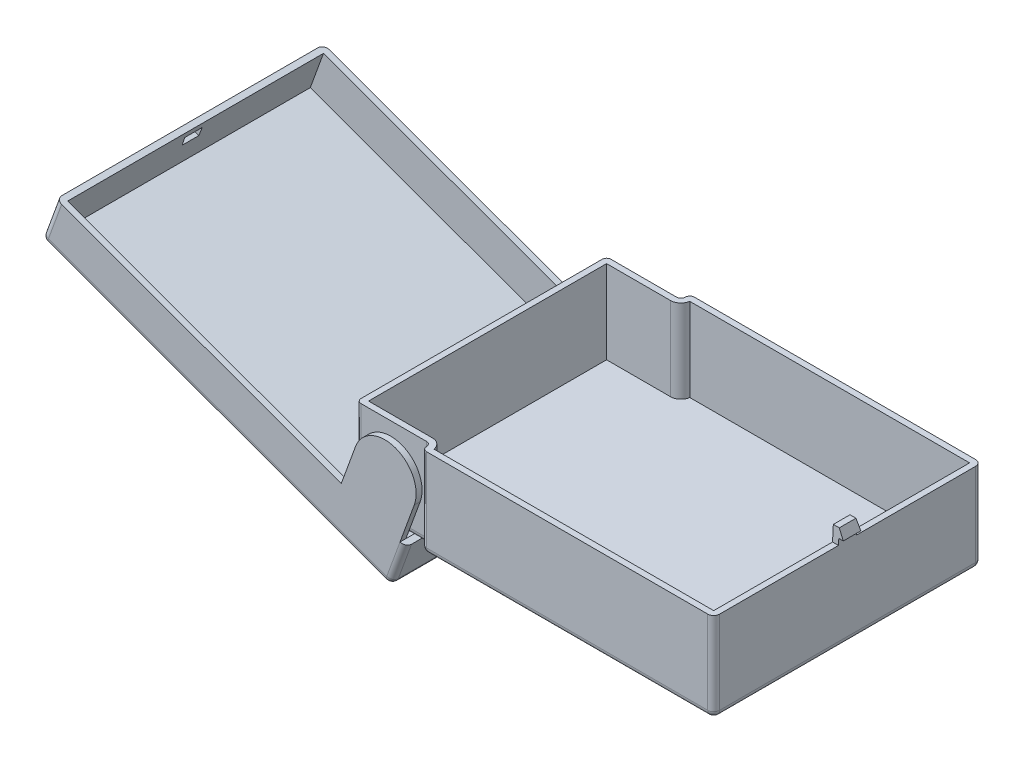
SolidWorks part; units mm, degrees
other "<snap-hook-2>-<Mirror5>"
ref_plane "Front Plane" through (0, 0, 0) normal (0, 0, 1) x (1, 0, 0)
ref_plane "Top Plane" through (0, 0, 0) normal (0, 1, 0) x (1, 0, 0)
ref_plane "Right Plane" through (0, 0, 0) normal (1, 0, 0) x (0, 0, -1)
sketch "Sketch1" plane through (0, 0, 0) normal (0, 1, 0) x (1, 0, 0)
  line L0 (-36.5, 45) -> (-36.5, 42)
  line L1 (-36.5, -45) -> (61.5, -45)
  line L2 (-61.5, -42) -> (-61.5, 42)
  line L3 (-36.5, 45) -> (61.5, 45)
  line L4 (61.5, -45) -> (61.5, 45)
  line L5 (-36.5, 42) -> (-61.5, 42)
  line L6 (-61.5, 0) -> (61.5, 0) construction
  line L8 (-36.5, -42) -> (-61.5, -42)
  line L9 (-36.5, -45) -> (-36.5, -42)
  dimension "D1" = 123
  dimension "D2" = 3
  dimension "D3" = 90
  dimension "D4" = 25
extrude "Extrude1" add sketch "Sketch1" along normal blind 30
fillet "Fillet1" radius 1.5 6 edges at (-36.5, 15, -45) (-36.5, 15, 45) (-36.5, 15, -42) (-61.5, 15, -42) (-61.5, 15, 42) (-36.5, 15, 42)
fillet "Fillet3" radius 2 2 edges at (61.5, 15, -45) (61.5, 15, 45)
fillet "Fillet2" radius 2 14 edges at (12.25, 0, -45) (-36.0607, 0, -44.5607) (-36.9393, 0, -42.4393) (-49, 0, -42) (-61.0607, 0, -41.5607) (-61.5, 0, 0) (-61.0607, 0, 41.5607) (-49, 0, 42) (-36.9393, 0, 42.4393) (-36.0607, 0, 44.5607) (61.5, 0, 0) (12.25, 0, 45) (60.9142, 0, -44.4142) (60.9142, 0, 44.4142)
shell "Shell1" thickness 2
sketch "Sketch2" plane through (0, 0, 42) normal (0, 0, 1) x (1, 0, 0)
  line L0 (-60, 30) -> (-38, 2) construction
  circle A0 centre (-49, 16) radius 1.25
  dimension "D1" = 2.5
extrude "Extrude2" add sketch "Sketch2" along normal blind 2
mirror "Mirror1" about plane through (0, 0, 0) normal (0, 0, 1) of "Extrude2"
sketch3d "3DSketch1"
  point P0 (61.5, 30, 0)
other "Snap Hook1" parameters "BaseDepth"=2, "TopDepth"=2, "Width"=5.6, "HookHeight"=3, "Overhang"=1.5, "BodyHeight"=2, "Draft"=3, "LipHeight"=0
inserted part "snap-hook-2"
move or copy body "Body-Move/Copy2" placed by mates yes
other "SnapGroove1" parameters "HeightOffset"=0, "WidthOffset"=0, "Clearance"=0, "Gap"=0, "GapHeight"=2
move or copy body "Body-Move/Copy3" bodies to move or copy 104 copy no rotation origin (-49, 16, 0) rotation axis (0, 0, 1) rotation angle 160
